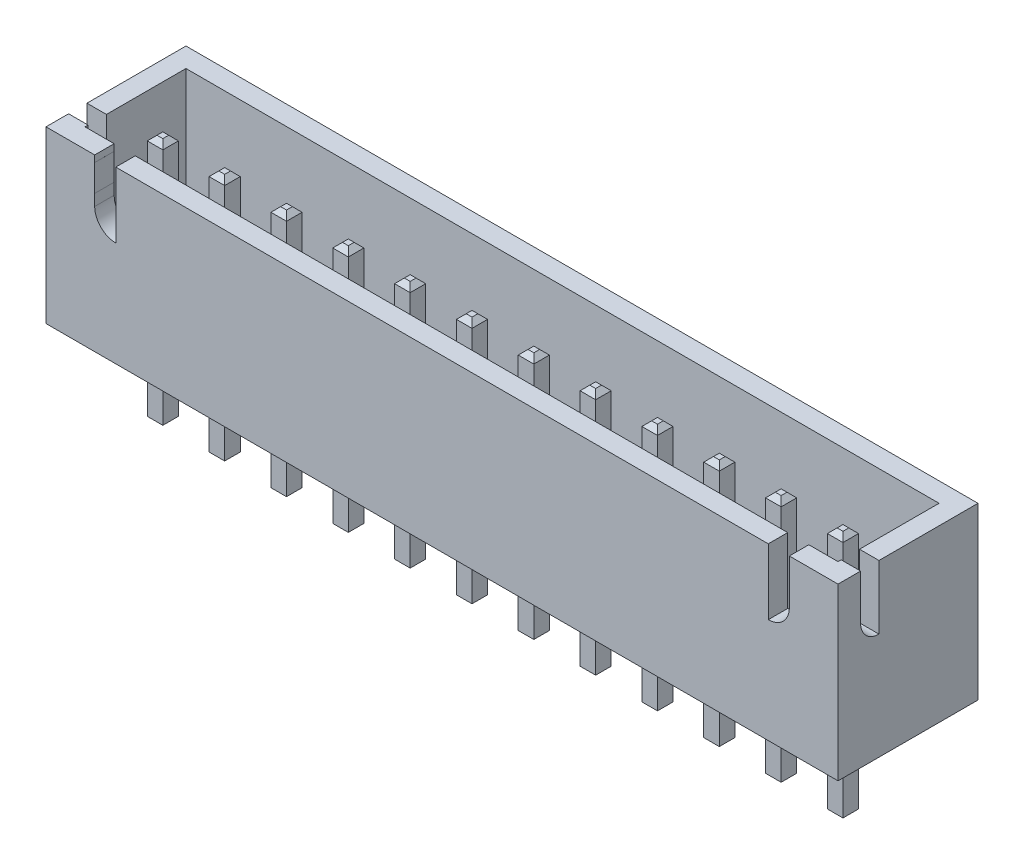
SolidWorks part; units mm, degrees
other "Camera1"
ref_plane "Front Plane" through (0, 0, 0) normal (0, 0, 1) x (1, 0, 0)
ref_plane "Top Plane" through (0, 0, 0) normal (0, 1, 0) x (1, 0, 0)
ref_plane "Right Plane" through (0, 0, 0) normal (1, 0, 0) x (0, 0, -1)
sketch "Sketch1" plane through (0, 0, 0) normal (0, 1, 0) x (1, 0, 0)
  line L1 (-16.2687, 2.875) -> (16.2687, 2.875)
  line L2 (-16.2687, 2.875) -> (-16.2687, -2.875)
  line L3 (-16.2687, -2.875) -> (16.2687, -2.875)
  line L4 (16.2687, 2.875) -> (16.2687, -2.875)
  line L5 (-16.2687, 2.875) -> (16.2687, -2.875) construction
  line L6 (-16.2687, -2.875) -> (16.2687, 2.875) construction
  point P0 (0, 0)
  dimension "D1" = 5.75
  dimension "D2" = 32.5374
extrude "Boss-Extrude1" add sketch "Sketch1" along normal blind 7
shell "Shell1" thickness 0.8
sketch "Sketch2" plane through (16.2687, 0, 0) normal (1, 0, 0) x (0, 0, -1)
  line L0 (-1.193, 7) -> (-1.193, 4.3796)
  line L1 (-2.875, 7) -> (2.875, 7) construction
  line L2 (-1.9469, 5.1335) -> (-1.9469, 7)
  line L3 (-1.9469, 7) -> (-1.193, 7)
  arc A0 (-1.193, 4.3796) -> (-1.9469, 5.1335) centre (-1.193, 5.1335) cw
extrude "Cut-Extrude1" cut sketch "Sketch2" against normal through all
sketch "Sketch3" plane through (0, 0, 2.875) normal (0, 0, 1) x (1, 0, 0)
  line L0 (-14.2687, 7) -> (-14.2687, 6.7289)
  line L1 (-16.2687, 7) -> (16.2687, 7) construction
  line L2 (-14.2687, 6.7289) -> (-14.2681, 6.7289)
  line L3 (-14.2681, 6.7289) -> (-14.2687, 5.6299)
  line L4 (-14.2687, 5.6299) -> (-14.2687, 5.1663)
  line L5 (-13.4025, 4.3001) -> (-13.4025, 7)
  line L6 (-13.4025, 7) -> (-14.2687, 7)
  line L7 (-16.2687, 7) -> (-16.2687, 0) construction
  line L8 (0, 7) -> (0, 0) construction
  line L9 (13.4025, 7) -> (14.2687, 7)
  line L10 (13.4025, 4.3001) -> (13.4025, 7)
  line L11 (14.2687, 5.6299) -> (14.2687, 5.1663)
  line L12 (14.2681, 6.7289) -> (14.2687, 5.6299)
  line L13 (14.2687, 6.7289) -> (14.2681, 6.7289)
  line L14 (14.2687, 7) -> (14.2687, 6.7289)
  arc A0 (-14.2687, 5.1663) -> (-13.4025, 4.3001) centre (-13.4025, 5.1663) ccw
  arc A1 (14.2687, 5.1663) -> (13.4025, 4.3001) centre (13.4025, 5.1663) cw
  point P23 (0, -167.0067)
  point P24 (-13.4025, 3.0322)
  point P25 (-14.2687, 5.6299)
  dimension "D1" = 2
extrude "Cut-Extrude2" cut sketch "Sketch3" against normal up to next
sketch "Sketch4" plane through (0, 0, 0) normal (0, -1, 0) x (1, 0, 0)
  line L0 (-16.2687, -2.875) -> (-16.2687, 2.875) construction
  line L1 (-14.1387, 0.845) -> (-13.4987, 0.845)
  line L2 (-14.1387, 0.845) -> (-14.1387, 0.205)
  line L3 (-14.1387, 0.205) -> (-13.4987, 0.205)
  line L4 (-13.4987, 0.845) -> (-13.4987, 0.205)
  line L5 (-14.1387, 0.845) -> (-13.4987, 0.205) construction
  line L6 (-14.1387, 0.205) -> (-13.4987, 0.845) construction
  line L7 (-11.5987, 0.205) -> (-10.9587, 0.205)
  line L8 (-11.5987, 0.845) -> (-11.5987, 0.205)
  line L9 (-16.2687, 2.875) -> (16.2687, 2.875) construction
  line L10 (-11.5987, 0.845) -> (-10.9587, 0.845)
  line L11 (-10.9587, 0.845) -> (-10.9587, 0.205)
  line L12 (-9.0587, 0.205) -> (-8.4187, 0.205)
  line L13 (-9.0587, 0.845) -> (-9.0587, 0.205)
  line L14 (-9.0587, 0.845) -> (-8.4187, 0.845)
  line L15 (-8.4187, 0.845) -> (-8.4187, 0.205)
  line L16 (-6.5187, 0.205) -> (-5.8787, 0.205)
  line L17 (-6.5187, 0.845) -> (-6.5187, 0.205)
  line L18 (-6.5187, 0.845) -> (-5.8787, 0.845)
  line L19 (-5.8787, 0.845) -> (-5.8787, 0.205)
  line L20 (-3.9787, 0.205) -> (-3.3387, 0.205)
  line L21 (-3.9787, 0.845) -> (-3.9787, 0.205)
  line L22 (-3.9787, 0.845) -> (-3.3387, 0.845)
  line L23 (-3.3387, 0.845) -> (-3.3387, 0.205)
  line L24 (-1.4387, 0.205) -> (-0.7987, 0.205)
  line L25 (-1.4387, 0.845) -> (-1.4387, 0.205)
  line L26 (-1.4387, 0.845) -> (-0.7987, 0.845)
  line L27 (-0.7987, 0.845) -> (-0.7987, 0.205)
  line L28 (1.1013, 0.205) -> (1.7413, 0.205)
  line L29 (1.1013, 0.845) -> (1.1013, 0.205)
  line L30 (1.1013, 0.845) -> (1.7413, 0.845)
  line L31 (1.7413, 0.845) -> (1.7413, 0.205)
  line L32 (3.6413, 0.205) -> (4.2813, 0.205)
  line L33 (3.6413, 0.845) -> (3.6413, 0.205)
  line L34 (3.6413, 0.845) -> (4.2813, 0.845)
  line L35 (4.2813, 0.845) -> (4.2813, 0.205)
  line L36 (6.1813, 0.205) -> (6.8213, 0.205)
  line L37 (6.1813, 0.845) -> (6.1813, 0.205)
  line L38 (6.1813, 0.845) -> (6.8213, 0.845)
  line L39 (6.8213, 0.845) -> (6.8213, 0.205)
  line L40 (8.7213, 0.205) -> (9.3613, 0.205)
  line L41 (8.7213, 0.845) -> (8.7213, 0.205)
  line L42 (8.7213, 0.845) -> (9.3613, 0.845)
  line L43 (9.3613, 0.845) -> (9.3613, 0.205)
  line L44 (11.2613, 0.205) -> (11.9013, 0.205)
  line L45 (11.2613, 0.845) -> (11.2613, 0.205)
  line L46 (11.2613, 0.845) -> (11.9013, 0.845)
  line L47 (11.9013, 0.845) -> (11.9013, 0.205)
  line L48 (13.8013, 0.205) -> (14.4413, 0.205)
  line L49 (13.8013, 0.845) -> (13.8013, 0.205)
  line L50 (13.8013, 0.845) -> (14.4413, 0.845)
  line L51 (14.4413, 0.845) -> (14.4413, 0.205)
  point P0 (-13.8187, 0.525)
  dimension "D1" = 0.64
  dimension "D2" = 0.64
  dimension "D3" = 2.45
  dimension "D4" = 2.35
  dimension "D5" = 12
extrude "Boss-Extrude2" add sketch "Sketch4" along normal blind 3.45 and the other way blind 6.75
chamfer "Chamfer1" distance 0.2 angle 45 96 edges at (-13.8187, -3.45, 0.205) (-14.1387, -3.45, 0.525) (-13.8187, -3.45, 0.845) (-13.4987, -3.45, 0.525) (-13.8187, 6.75, 0.845) (-14.1387, 6.75, 0.525) (-13.8187, 6.75, 0.205) (-13.4987, 6.75, 0.525) (-11.2787, -3.45, 0.205) (-11.5987, -3.45, 0.525) (-11.2787, -3.45, 0.845) (-10.9587, -3.45, 0.525) (-8.7387, -3.45, 0.205) (-9.0587, -3.45, 0.525) (-8.7387, -3.45, 0.845) (-8.4187, -3.45, 0.525) (-6.1987, -3.45, 0.205) (-6.5187, -3.45, 0.525) (-6.1987, -3.45, 0.845) (-5.8787, -3.45, 0.525) (-3.6587, -3.45, 0.205) (-3.9787, -3.45, 0.525) (-3.6587, -3.45, 0.845) (-3.3387, -3.45, 0.525) (-1.1187, -3.45, 0.205) (-1.4387, -3.45, 0.525) (-1.1187, -3.45, 0.845) (-0.7987, -3.45, 0.525) (14.1213, -3.45, 0.205) (13.8013, -3.45, 0.525) (14.1213, -3.45, 0.845) (14.4413, -3.45, 0.525) (1.4213, -3.45, 0.205) (1.1013, -3.45, 0.525) (1.4213, -3.45, 0.845) (1.7413, -3.45, 0.525) (3.9613, -3.45, 0.205) (3.6413, -3.45, 0.525) (3.9613, -3.45, 0.845) (4.2813, -3.45, 0.525) (6.5013, -3.45, 0.205) (6.1813, -3.45, 0.525) (6.5013, -3.45, 0.845) (6.8213, -3.45, 0.525) (9.0413, -3.45, 0.205) (8.7213, -3.45, 0.525) (9.0413, -3.45, 0.845) (9.3613, -3.45, 0.525) (11.5813, -3.45, 0.205) (11.2613, -3.45, 0.525) (11.5813, -3.45, 0.845) (11.9013, -3.45, 0.525) (14.1213, 6.75, 0.845) (13.8013, 6.75, 0.525) (14.1213, 6.75, 0.205) (14.4413, 6.75, 0.525) (11.5813, 6.75, 0.845) (11.2613, 6.75, 0.525) (11.5813, 6.75, 0.205) (11.9013, 6.75, 0.525) (9.0413, 6.75, 0.845) (8.7213, 6.75, 0.525) (9.0413, 6.75, 0.205) (9.3613, 6.75, 0.525) (6.5013, 6.75, 0.845) (6.1813, 6.75, 0.525) (6.5013, 6.75, 0.205) (6.8213, 6.75, 0.525) (3.9613, 6.75, 0.845) (3.6413, 6.75, 0.525) (3.9613, 6.75, 0.205) (4.2813, 6.75, 0.525) (1.4213, 6.75, 0.845) (1.1013, 6.75, 0.525) (1.4213, 6.75, 0.205) (1.7413, 6.75, 0.525) (-1.1187, 6.75, 0.845) (-1.4387, 6.75, 0.525) (-1.1187, 6.75, 0.205) (-0.7987, 6.75, 0.525) (-3.6587, 6.75, 0.845) (-3.9787, 6.75, 0.525) (-3.6587, 6.75, 0.205) (-3.3387, 6.75, 0.525) (-6.1987, 6.75, 0.845) (-6.5187, 6.75, 0.525) (-6.1987, 6.75, 0.205) (-5.8787, 6.75, 0.525) (-8.7387, 6.75, 0.845) (-9.0587, 6.75, 0.525) (-8.7387, 6.75, 0.205) (-8.4187, 6.75, 0.525) (-11.2787, 6.75, 0.845) (-11.5987, 6.75, 0.525) (-11.2787, 6.75, 0.205) (-10.9587, 6.75, 0.525)
